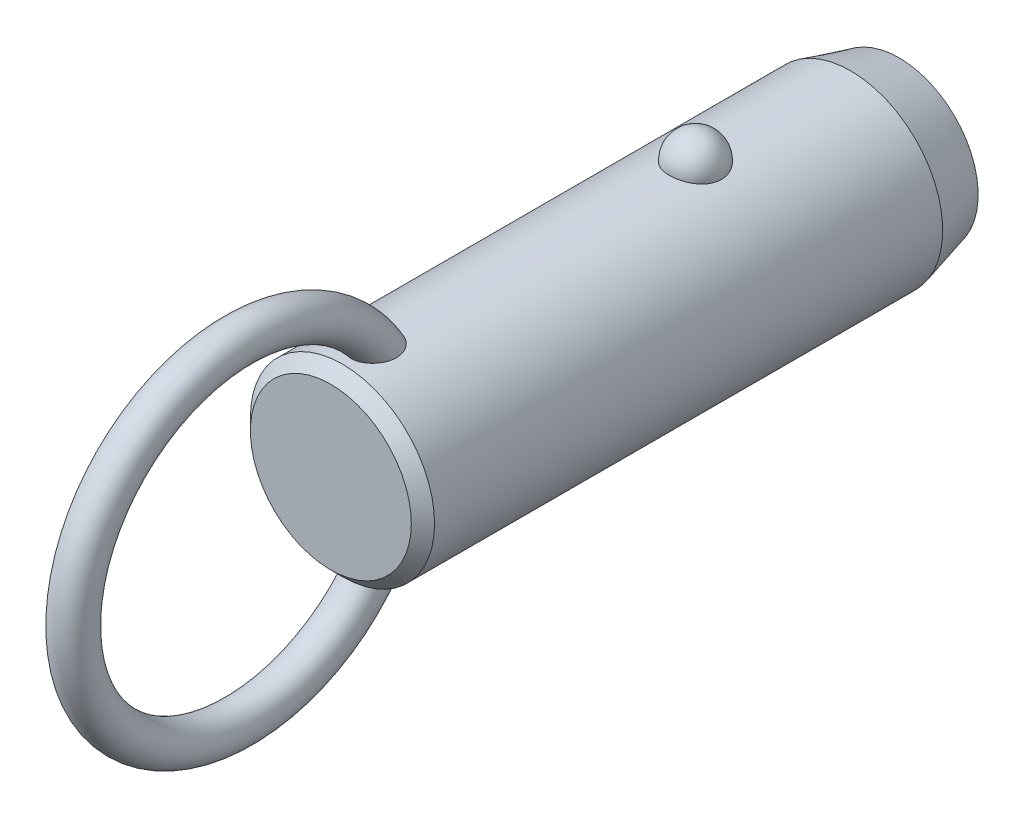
SolidWorks part; units mm, degrees
ref_plane "Front Plane" through (0, 0, 0) normal (0, 0, 1) x (1, 0, 0)
ref_plane "Top Plane" through (0, 0, 0) normal (0, 1, 0) x (1, 0, 0)
ref_plane "Right Plane" through (0, 0, 0) normal (1, 0, 0) x (0, 0, -1)
sketch "Sketch2" plane through (0, 0, 0) normal (0, 0, 1) x (1, 0, 0)
  circle A0 centre (0, 0) radius 9.5
  point P3 (0, 9.5)
  dimension "D1" = 19
extrude "Boss-Extrude1" add sketch "Sketch2" along normal blind 25.4
sketch "Sketch3" plane through (0, 0, 0) normal (0, 0, -1) x (-1, 0, 0)
  circle A0 centre (0, 0) radius 9.5
  dimension "D1" = 19
extrude "Boss-Extrude2" add sketch "Sketch3" along normal blind 23.7
chamfer "Chamfer1" distance 5 angle 15 1 edges at (-9.5, 0, -23.7)
sketch "Sketch12" plane through (0, 0, 0) normal (1, 0, 0) x (0, 0, -1)
  line L0 (-25.4, 9.5) -> (-25.4, -9.5) construction
  point P0 (-25.4, 0)
sketch "Sketch13" plane through (0, 0, 0) normal (1, 0, 0) x (0, 0, -1)
  circle A0 centre (-44.45, 0) radius 19.05
  point P2 (-25.4, 0)
  dimension "D1" = 38.1
sketch "Sketch14" plane through (0, 0, 0) normal (0, 1, 0) x (1, 0, 0)
  circle A0 centre (0, -27.4) radius 2
  point P2 (0, -25.4)
  dimension "D1" = 4
sweep "Sweep1" add profiles "Sketch14" path "Sketch13"
sketch "Sketch15" plane through (0, 0, 25.4) normal (0, 0, 1) x (1, 0, 0)
  circle A0 centre (0, 0) radius 9.5
  dimension "D1" = 19
extrude "Boss-Extrude3" add sketch "Sketch15" along normal blind 9.52
chamfer "Chamfer2" distance 1.2 angle 45 1 edges at (9.5, 0, 34.92)
sketch "Sketch18" plane through (0, 0, 0) normal (1, 0, 0) x (0, 0, -1)
  line L0 (18.7, 9.5) -> (-27.9378, 9.5) construction
  line L1 (2.7, 12.2) -> (2.7, 6.8)
  line L2 (-27.9378, -9.5) -> (18.7, -9.5) construction
  arc A0 (2.7, 12.2) -> (2.7, 6.8) centre (2.7, 9.5) ccw
  point P4 (0, 9.5)
  dimension "D1" = 21.7
revolve "Revolve1" add sketch "Sketch18" angle 360 about L1
